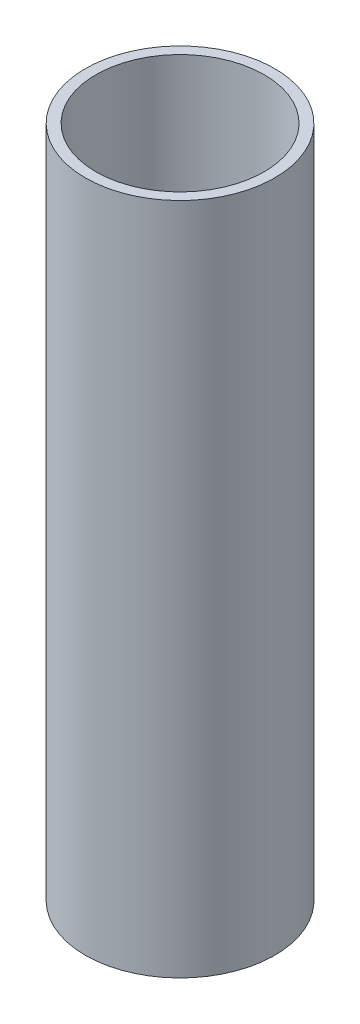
SolidWorks part; units mm, degrees
ref_plane "Front" through (0, 0, 0) normal (0, 0, 1) x (1, 0, 0)
ref_plane "Top" through (0, 0, 0) normal (0, 1, 0) x (1, 0, 0)
ref_plane "Right" through (0, 0, 0) normal (1, 0, 0) x (0, 0, -1)
sketch "Sketch1" plane through (0, 0, 0) normal (0, 1, 0) x (1, 0, 0)
  circle A0 centre (0, 0) radius 7.1438
  circle A1 centre (0, 0) radius 6.35
  dimension "D1" = 12.7
  dimension "D2" = 14.2875
extrude "Boss-Extrude1" add sketch "Sketch1" along normal blind 50.8
